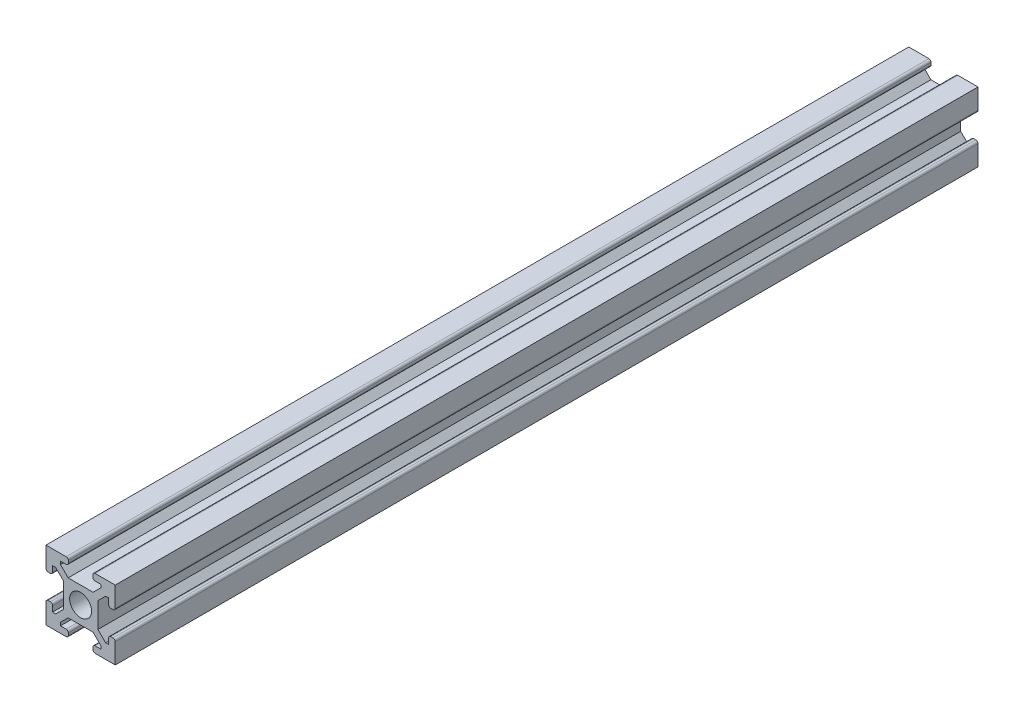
SolidWorks part; units mm, degrees
ref_plane "Front Plane" through (0, 0, 0) normal (0, 0, 1) x (1, 0, 0)
ref_plane "Top Plane" through (0, 0, 0) normal (0, 1, 0) x (1, 0, 0)
ref_plane "Right Plane" through (0, 0, 0) normal (1, 0, 0) x (0, 0, -1)
sketch "Sketch1" plane through (0, 0, 0) normal (0, 0, 1) x (1, 0, 0)
  line L0 (7.1042, 20.066) -> (7.1042, 16.256)
  line L1 (-20.066, 20.066) -> (20.066, 20.066)
  line L2 (-20.066, 20.066) -> (-20.066, -20.066)
  line L3 (-20.066, -20.066) -> (20.066, -20.066)
  line L4 (20.066, 20.066) -> (20.066, -20.066)
  line L5 (-20.066, 20.066) -> (20.066, -20.066) construction
  line L6 (-20.066, -20.066) -> (20.066, 20.066) construction
  line L7 (-10.033, 10.033) -> (10.033, 10.033)
  line L8 (-10.033, 10.033) -> (-10.033, -10.033)
  line L9 (-10.033, -10.033) -> (10.033, -10.033)
  line L10 (10.033, 10.033) -> (10.033, -10.033)
  line L11 (-10.033, 10.033) -> (10.033, -10.033) construction
  line L12 (-10.033, -10.033) -> (10.033, 10.033) construction
  line L13 (7.1042, 16.256) -> (11.6762, 16.256)
  line L14 (10.033, 7.2312) -> (14.478, 11.6762)
  line L15 (14.478, 11.6762) -> (16.256, 11.6762)
  line L16 (7.2312, 10.033) -> (11.6762, 14.478)
  line L17 (11.6762, 14.478) -> (11.6762, 16.256)
  line L18 (16.256, 7.1042) -> (16.256, 11.6762)
  line L19 (20.066, 7.1042) -> (16.256, 7.1042)
  line L20 (0, 20.066) -> (0, -20.066) construction
  line L21 (-20.066, 0) -> (20.066, 0) construction
  line L22 (-14.478, 11.6762) -> (-16.256, 11.6762)
  line L23 (-20.066, 7.1042) -> (-16.256, 7.1042)
  line L24 (-16.256, 7.1042) -> (-16.256, 11.6762)
  line L25 (-10.033, 7.2312) -> (-14.478, 11.6762)
  line L26 (-7.2312, 10.033) -> (-11.6762, 14.478)
  line L27 (-11.6762, 14.478) -> (-11.6762, 16.256)
  line L28 (-7.1042, 16.256) -> (-11.6762, 16.256)
  line L29 (-7.1042, 20.066) -> (-7.1042, 16.256)
  line L30 (20.066, -7.1042) -> (16.256, -7.1042)
  line L31 (16.256, -7.1042) -> (16.256, -11.6762)
  line L32 (14.478, -11.6762) -> (16.256, -11.6762)
  line L33 (10.033, -7.2312) -> (14.478, -11.6762)
  line L34 (7.2312, -10.033) -> (11.6762, -14.478)
  line L35 (11.6762, -14.478) -> (11.6762, -16.256)
  line L36 (7.1042, -16.256) -> (11.6762, -16.256)
  line L37 (7.1042, -20.066) -> (7.1042, -16.256)
  line L38 (-7.1042, -20.066) -> (-7.1042, -16.256)
  line L39 (-7.1042, -16.256) -> (-11.6762, -16.256)
  line L40 (-11.6762, -14.478) -> (-11.6762, -16.256)
  line L41 (-7.2312, -10.033) -> (-11.6762, -14.478)
  line L42 (-14.478, -11.6762) -> (-16.256, -11.6762)
  line L43 (-10.033, -7.2312) -> (-14.478, -11.6762)
  line L44 (-16.256, -7.1042) -> (-16.256, -11.6762)
  line L45 (-20.066, -7.1042) -> (-16.256, -7.1042)
  circle A0 centre (0, 0) radius 6.35
  point P0 (0, 0)
  point P6 (0, 0)
  point P16 (11.6762, 15.367)
  point P20 (15.367, 11.6762)
  dimension "D4" = 3.81
  dimension "D1" = 40.132
  dimension "D2" = 40.132
  dimension "D3" = 20.066
  dimension "D5" = 4.572
  dimension "D6" = 1.778
extrude "Boss-Extrude1" add sketch "Sketch1" along normal blind 499.999 contours L29 L1 L2 L23 L24 L22 L25 L8 L7 L26 L27 L28 | L19 L4 L1 L0 L13 L17 L16 L7 L10 L14 L15 L18 | L10 L7 L8 L9 A0 | L37 L3 L4 L30 L31 L32 L33 L10 L9 L34 L35 L36 | L45 L2 L3 L38 L39 L40 L41 L9 L8 L43 L42 L44
fillet "Fillet1" radius 1.27 16 edges at (-20.066, -7.1042, 249.9995) (-16.256, -7.1042, 249.9995) (-7.1042, -20.066, 249.9995) (-7.1042, -16.256, 249.9995) (7.1042, -20.066, 249.9995) (7.1042, -16.256, 249.9995) (16.256, -7.1042, 249.9995) (20.066, -7.1042, 249.9995) (20.066, 7.1042, 249.9995) (16.256, 7.1042, 249.9995) (7.1042, 16.256, 249.9995) (7.1042, 20.066, 249.9995) (-20.066, 7.1042, 249.9995) (-16.256, 7.1042, 249.9995) (-7.1042, 16.256, 249.9995) (-7.1042, 20.066, 249.9995)
